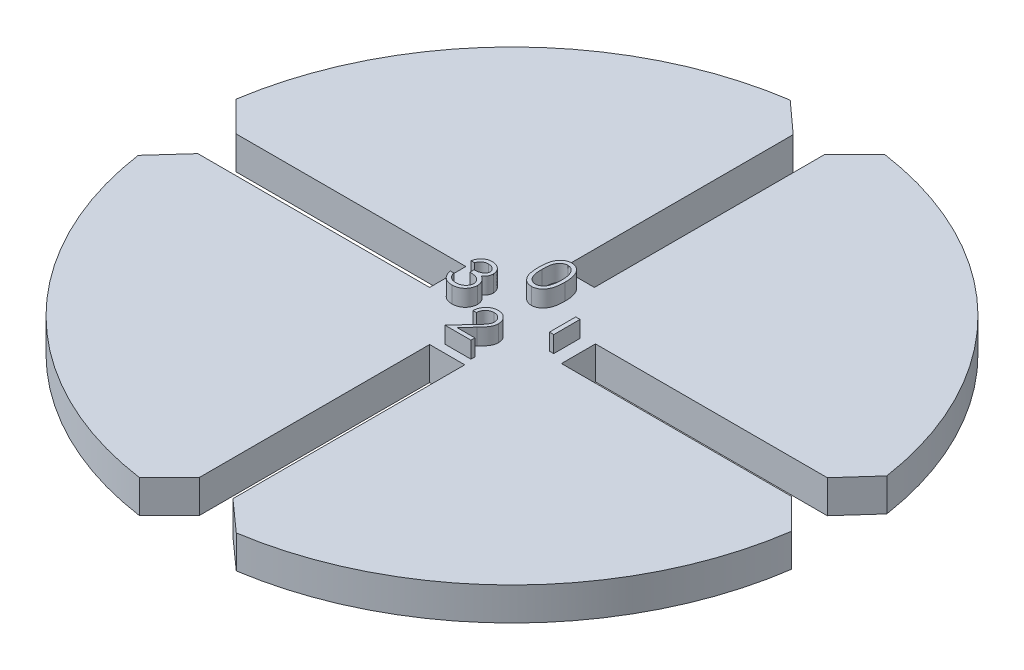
SolidWorks part; units mm, degrees
ref_plane "Alzado" through (0, 0, 0) normal (0, 0, 1) x (1, 0, 0)
ref_plane "Planta" through (0, 0, 0) normal (0, 1, 0) x (1, 0, 0)
ref_plane "Vista lateral" through (0, 0, 0) normal (1, 0, 0) x (0, 0, -1)
sketch "Croquis1" plane through (0, 0, 0) normal (0, 1, 0) x (1, 0, 0)
  circle A0 centre (0, 0) radius 30
  dimension "D1" = 60
extrude "Saliente-Extruir1" add sketch "Croquis1" along normal blind 3
sketch "Croquis3" plane through (0, 3, 0) normal (0, 1, 0) x (1, 0, 0)
  line L0 (0, 0) -> (0, 6)
  line L1 (30, 0) -> (-30, 0)
  line L2 (0, 0) -> (-6, 0)
  line L3 (-6, -1.5) -> (-6, 1.8)
  line L4 (-6, -1.5) -> (-31.4437, -1.5)
  line L5 (-31.4437, -1.5) -> (-31.4437, 1.8)
  line L6 (-1.5, 6) -> (1.5, 6)
  line L7 (-1.5, 6) -> (-1.5, 31.4437)
  line L8 (-1.5, 31.4437) -> (1.5, 31.4437)
  line L9 (1.5, 6) -> (1.5, 31.4437)
  line L10 (-6, 1.8) -> (-31.4437, 1.8)
  line L11 (0, 0) -> (0, -6)
  line L12 (1.7, -6) -> (-1.5, -6)
  line L13 (1.7, -6) -> (1.7, -31.4437)
  line L14 (1.7, -31.4437) -> (-1.5, -31.4437)
  line L15 (-1.5, -6) -> (-1.5, -31.4437)
  line L16 (0, 0) -> (6, 0)
  line L17 (6, 1.6) -> (6, -1.5)
  line L18 (6, 1.6) -> (31.4437, 1.6)
  line L19 (31.4437, 1.6) -> (31.4437, -1.5)
  line L20 (6, -1.5) -> (31.4437, -1.5)
  circle A0 centre (0, 0) radius 30 construction
  dimension "D1" = 3.3
  dimension "D2" = 3
  dimension "D3" = 3.2
  dimension "D4" = 3.1
extrude "Cortar-Extruir1" cut sketch "Croquis3" against normal blind 3 contours L9 L8 L7 L6 | L20 L19 L18 L17 | L13 L14 L15 L12 | L4 L5 L10 L3
sketch "Croquis4" plane through (0, 3, 0) normal (0, 1, 0) x (1, 0, 0)
  line L2 (4.4749, 1.3303) -> (4.8674, 1.3303)
  line L3 (4.4749, 1.3303) -> (4.4749, -1.0681)
  line L4 (4.4749, -1.0681) -> (4.8674, -1.0681)
  line L5 (4.8674, 1.3303) -> (4.8674, -1.0681)
  text T0 "2"
  text T1 "0"
  text T2 "3"
extrude "Saliente-Extruir2" add sketch "Croquis4" along normal blind 1.5
chamfer "Chaflán1" distance 3 angle 45 8 edges at (1.7, 1.5, 29.9518) (-1.5, 1.5, 29.9625) (-29.9625, 1.5, 1.5) (-29.946, 1.5, -1.8) (1.5, 1.5, -29.9625) (-1.5, 1.5, -29.9625) (29.9625, 1.5, 1.5) (29.9573, 1.5, -1.6)
